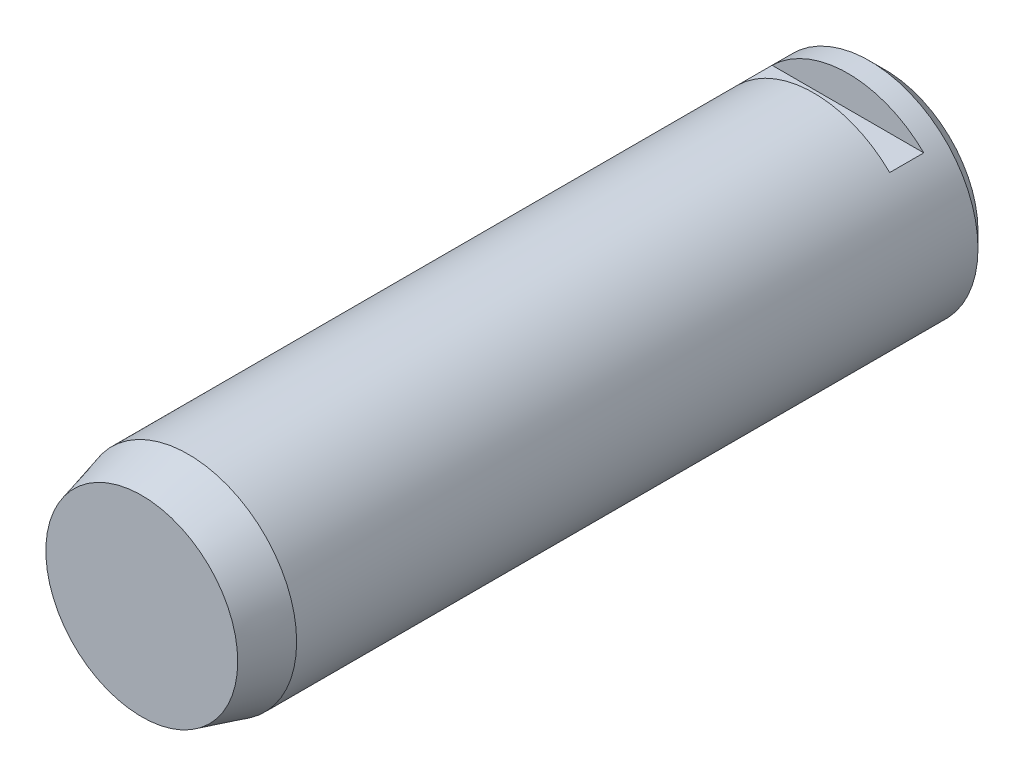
SolidWorks part; units mm, degrees
ref_plane "Plan de face" through (0, 0, 0) normal (0, 0, 1) x (1, 0, 0)
ref_plane "Plan de dessus" through (0, 0, 0) normal (0, 1, 0) x (1, 0, 0)
ref_plane "Plan de droite" through (0, 0, 0) normal (1, 0, 0) x (0, 0, -1)
sketch "Esquisse1" plane through (0, 0, 0) normal (0, 0, 1) x (1, 0, 0)
  circle A0 centre (0, 0) radius 35
  dimension "D1" = 70
extrude "Extrusion1" add sketch "Esquisse1" along normal blind 240
chamfer "Chanfrein1" distance 15 angle 15 1 edges at (35, 0, 240)
ref_plane "Plan1" through (0, 25, 0) normal (0, 1, 0) x (-1, 0, 0)
sketch "Esquisse2" plane through (0, 25, 0) normal (0, 1, 0) x (-1, 0, 0)
  line L0 (-35, 225) -> (-35, 0) construction
  line L1 (-35, 12) -> (35, 12)
  line L2 (-35, 12) -> (-35, 23)
  line L3 (-35, 23) -> (35, 23)
  line L4 (35, 12) -> (35, 23)
  line L5 (35, 0) -> (35, 225) construction
  line L8 (-35, 0) -> (35, 0) construction
  dimension "D1" = 23
  dimension "D2" = 11
extrude "Enlèv. mat.-Extru.1" cut sketch "Esquisse2" along normal up to next
chamfer "Chanfrein2" distance 5 angle 45 1 edges at (35, 0, 0)
